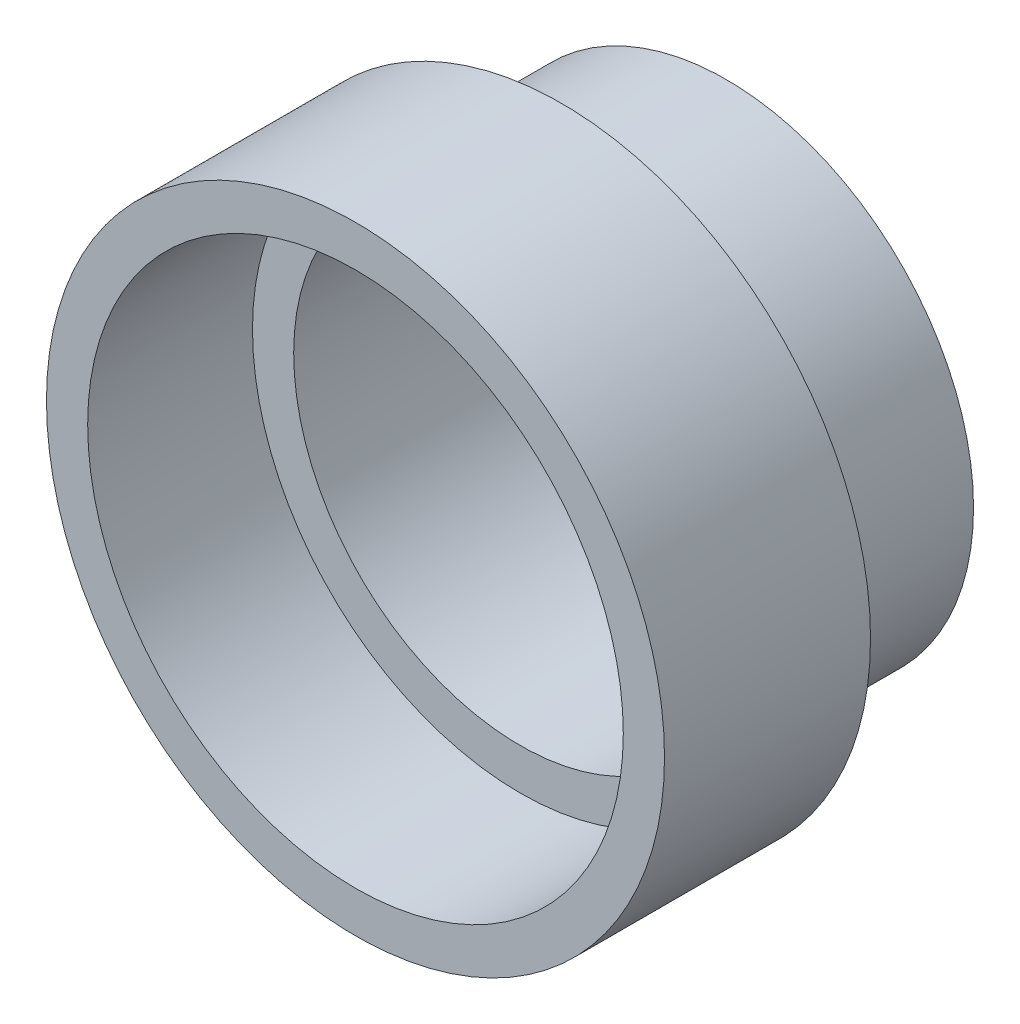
SolidWorks part; units mm, degrees
ref_plane "Front Plane" through (0, 0, 0) normal (0, 0, 1) x (1, 0, 0)
ref_plane "Top Plane" through (0, 0, 0) normal (0, 1, 0) x (1, 0, 0)
ref_plane "Right Plane" through (0, 0, 0) normal (1, 0, 0) x (0, 0, -1)
sketch "Sketch1" plane through (0, 0, 0) normal (0, 0, 1) x (1, 0, 0)
  circle A0 centre (0, 0) radius 15
  dimension "D1" = 30
extrude "Boss-Extrude1" add sketch "Sketch1" along normal blind 10 contours A0
sketch "Sketch2" plane through (0, 0, 10) normal (0, 0, 1) x (1, 0, 0)
  circle A0 centre (0, 0) radius 13
  dimension "D1" = 26
extrude "Cut-Extrude2" cut sketch "Sketch2" against normal blind 8
sketch "Sketch4" plane through (0, 0, 0) normal (0, 0, -1) x (-1, 0, 0)
  circle A0 centre (0, 0) radius 12
  dimension "D1" = 24
extrude "Boss-Extrude2" add sketch "Sketch4" along normal blind 8
sketch "Sketch5" plane through (0, 0, -8) normal (0, 0, -1) x (-1, 0, 0)
  circle A0 centre (0, 0) radius 11
  dimension "D1" = 22
extrude "Cut-Extrude3" cut sketch "Sketch5" against normal blind 30 contours A0
